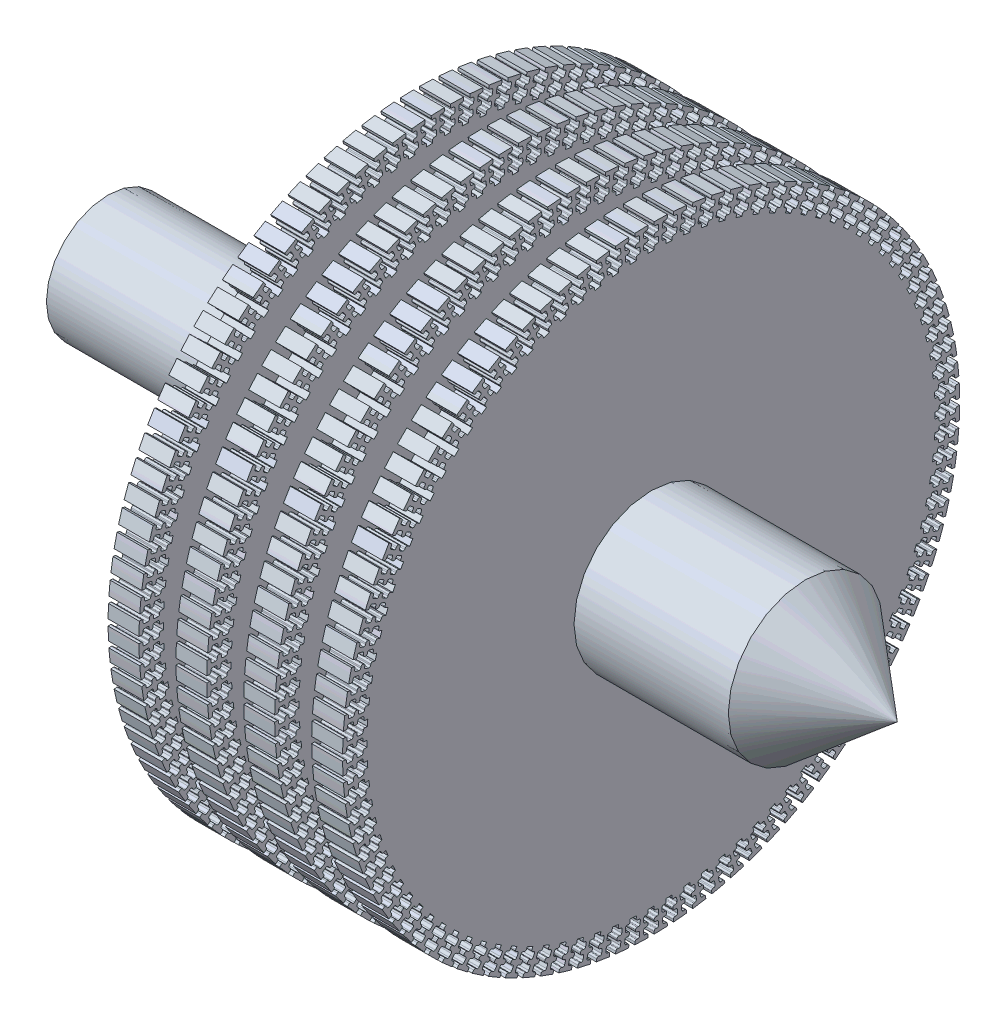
SolidWorks part; units mm, degrees
ref_plane "Front Plane" through (0, 0, 0) normal (0, 0, 1) x (1, 0, 0)
ref_plane "Top Plane" through (0, 0, 0) normal (0, 1, 0) x (1, 0, 0)
ref_plane "Right Plane" through (0, 0, 0) normal (1, 0, 0) x (0, 0, -1)
sketch "Sketch1" plane through (0, 0, 0) normal (0, 0, 1) x (1, 0, 0)
  line L0 (-203.9654, 0) -> (273.0965, 0) construction
  line L1 (-107.4104, 0) -> (-107.4104, 500)
  line L2 (-107.4104, 500) -> (-57.4104, 500)
  line L3 (-57.4104, 500) -> (-57.4104, 0)
  line L4 (-107.4104, 0) -> (-57.4104, 0)
  line L5 (-107.4104, 0) -> (-57.4104, 0)
  dimension "D1" = 500
  dimension "D2" = 50
revolve "Revolve4" add sketch "Sketch1" angle 360 about L0
sketch "Sketch2" plane through (-107.4104, 0, 0) normal (-1, 0, 0) x (0, 0, 1)
  circle A0 centre (0, 0) radius 100
extrude "Boss-Extrude1" add sketch "Sketch2" along normal blind 60
sketch "Sketch3" plane through (-167.4104, 0, 0) normal (-1, 0, 0) x (0, 0, 1)
  circle A0 centre (0, 0) radius 500
extrude "Boss-Extrude2" add sketch "Sketch3" along normal blind 50
sketch "Sketch4" plane through (-217.4104, 0, 0) normal (-1, 0, 0) x (0, 0, 1)
  circle A0 centre (0, 0) radius 100
  dimension "D1" = 200
extrude "Boss-Extrude3" add sketch "Sketch4" along normal blind 60
sketch "Sketch5" plane through (-277.4104, 0, 0) normal (-1, 0, 0) x (0, 0, 1)
  circle A0 centre (0, 0) radius 500
extrude "Boss-Extrude4" add sketch "Sketch5" along normal blind 50
sketch "Sketch6" plane through (-327.4104, 0, 0) normal (-1, 0, 0) x (0, 0, 1)
  circle A0 centre (0, 0) radius 100
extrude "Boss-Extrude5" add sketch "Sketch6" along normal blind 60 contours A0
sketch "Sketch7" plane through (-387.4104, 0, 0) normal (-1, 0, 0) x (0, 0, 1)
  circle A0 centre (0, 0) radius 500
extrude "Boss-Extrude6" add sketch "Sketch7" along normal blind 50
sketch "Sketch8" plane through (-437.4104, 0, 0) normal (-1, 0, 0) x (0, 0, 1)
  circle A0 centre (0, 0) radius 100
  dimension "D1" = 200
extrude "Boss-Extrude7" add sketch "Sketch8" along normal blind 500
sketch "Sketch9" plane through (-57.4104, 0, 0) normal (1, 0, 0) x (0, 0, -1)
  line L0 (0, 543.3818) -> (0, -559.3587) construction
  line L1 (-9.5, 493.475) -> (-7.5, 493.475)
  line L2 (-5, 495.975) -> (-5, 499.975)
  line L3 (-12, 490.975) -> (-12, 485.975)
  line L4 (-9.5, 483.475) -> (-7.543, 483.475)
  line L5 (-5.0432, 481.0012) -> (-5.0265, 479.4097)
  line L6 (-7.5263, 476.8835) -> (-9.5, 476.8835)
  line L7 (-12, 474.3835) -> (-12, 469.3835)
  line L8 (-9.5, 466.8835) -> (-7.5, 466.8835)
  line L9 (-5, 464.3835) -> (-5, 462.8835)
  line L10 (-2.5, 460.3835) -> (2.5, 460.3835)
  line L11 (-5, 462.8835) -> (-5, 460.3835)
  line L12 (5, 499.975) -> (5, 495.975)
  line L13 (5, 464.3835) -> (5, 462.8835)
  line L14 (9.5, 466.8835) -> (7.5, 466.8835)
  line L15 (12, 474.3835) -> (12, 469.3835)
  line L16 (7.5263, 476.8835) -> (9.5, 476.8835)
  line L17 (5.0432, 481.0012) -> (5.0265, 479.4097)
  line L18 (9.5, 483.475) -> (7.543, 483.475)
  line L19 (12, 490.975) -> (12, 485.975)
  line L20 (9.5, 493.475) -> (7.5, 493.475)
  line L21 (-5, 460.3835) -> (-2.5, 460.3835)
  line L22 (2.5, 460.3835) -> (5, 460.3835)
  line L23 (5, 460.3835) -> (5, 462.8835)
  circle A0 centre (0, 0) radius 500 construction
  circle A1 centre (0, 0) radius 500
  arc A2 (-5, 495.975) -> (-7.5, 493.475) centre (-7.5, 495.975) cw
  arc A3 (-12, 490.975) -> (-9.5, 493.475) centre (-9.5, 490.975) cw
  arc A4 (-12, 485.975) -> (-9.5, 483.475) centre (-9.5, 485.975) ccw
  arc A5 (-7.543, 483.475) -> (-5.0432, 481.0012) centre (-7.543, 480.975) cw
  arc A6 (-5.0265, 479.4097) -> (-7.5263, 476.8835) centre (-7.5263, 479.3835) cw
  arc A7 (-12, 474.3835) -> (-9.5, 476.8835) centre (-9.5, 474.3835) cw
  arc A8 (-12, 469.3835) -> (-9.5, 466.8835) centre (-9.5, 469.3835) ccw
  arc A10 (-7.5, 466.8835) -> (-5, 464.3835) centre (-7.5, 464.3835) cw
  arc A12 (7.5, 466.8835) -> (5, 464.3835) centre (7.5, 464.3835) ccw
  arc A13 (12, 474.3835) -> (9.5, 476.8835) centre (9.5, 474.3835) ccw
  arc A14 (12, 469.3835) -> (9.5, 466.8835) centre (9.5, 469.3835) cw
  arc A15 (5.0265, 479.4097) -> (7.5263, 476.8835) centre (7.5263, 479.3835) ccw
  arc A16 (7.543, 483.475) -> (5.0432, 481.0012) centre (7.543, 480.975) ccw
  arc A17 (12, 485.975) -> (9.5, 483.475) centre (9.5, 485.975) cw
  arc A18 (12, 490.975) -> (9.5, 493.475) centre (9.5, 490.975) ccw
  arc A19 (5, 495.975) -> (7.5, 493.475) centre (7.5, 495.975) ccw
  circle A20 centre (0, 0) radius 500 construction
  circle A21 centre (0, 0) radius 500
  circle A22 centre (0, 0) radius 500 construction
  circle A23 centre (0, 0) radius 500
  circle A24 centre (0, 0) radius 500 construction
  circle A25 centre (0, 0) radius 500
  circle A26 centre (0, 0) radius 500
  point P20 (-5, 493.475)
  point P23 (-12, 493.475)
  point P26 (-12, 483.475)
  point P31 (-5, 476.8835)
  point P34 (-12, 476.8835)
  point P37 (-12, 466.8835)
  point P40 (-5, 460.3835)
  point P43 (-5, 466.8835)
  point P46 (0, 460.3835)
  dimension "D10" = 2.5
  dimension "D11" = 2.5
  dimension "D1" = 7
  dimension "D2" = 10
  dimension "D4" = 10
  dimension "D5" = 7
  dimension "D6" = 6.5
  dimension "D8" = 5
  dimension "D9" = 12
extrude "Cut-Extrude1" cut sketch "Sketch9" against normal through all
pattern_circular "CirPattern3" count 100 over 360 about axis through (-57.4104, 0, 0) along (-1, 0, 0) of "Cut-Extrude1"
sketch "Sketch10" plane through (-57.4104, 0, 0) normal (1, 0, 0) x (0, 0, -1)
  circle A0 centre (0, 0) radius 125
  dimension "D1" = 250
extrude "Boss-Extrude8" add sketch "Sketch10" along normal blind 250
sketch "Sketch11" plane through (192.5896, 0, 0) normal (1, 0, 0) x (0, 0, -1)
  circle A0 centre (0, 0) radius 125
extrude "Boss-Extrude9" add sketch "Sketch11" along normal blind 200 draft 40
